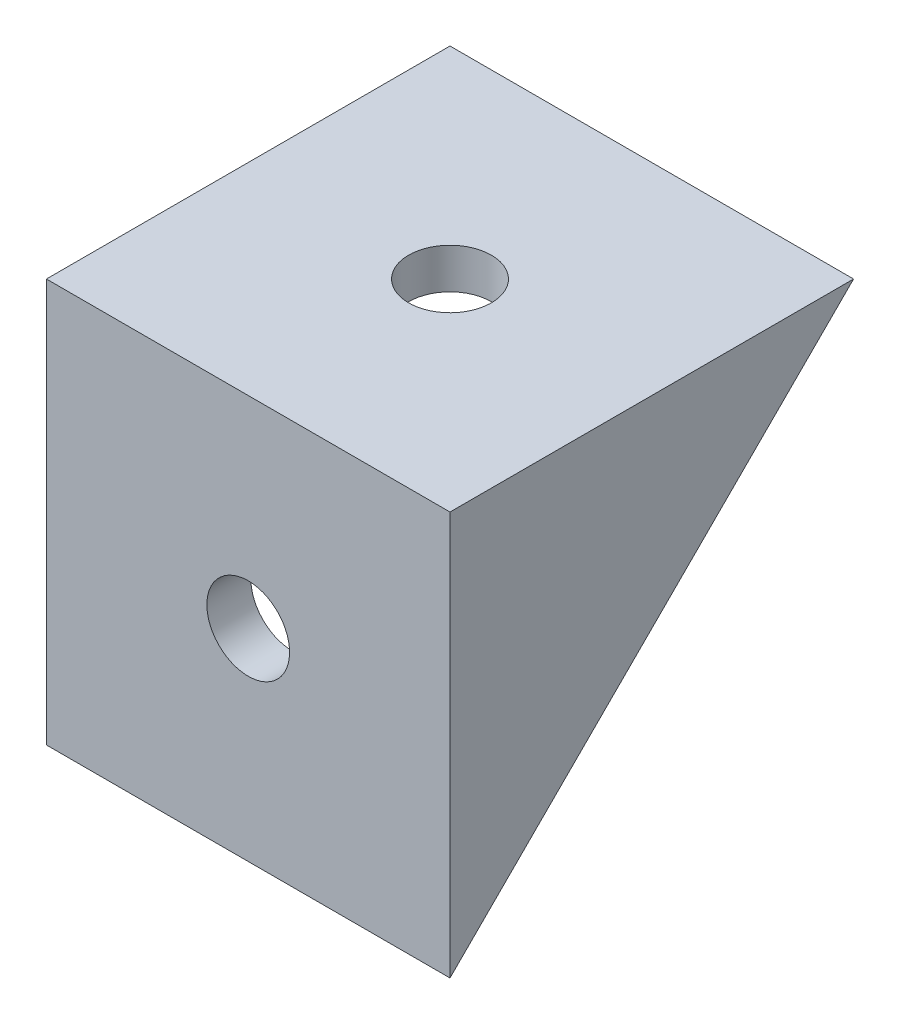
SolidWorks part; units mm, degrees
ref_plane "Ebene vorne" through (0, 0, 0) normal (0, 0, 1) x (1, 0, 0)
ref_plane "Ebene oben" through (0, 0, 0) normal (0, 1, 0) x (1, 0, 0)
ref_plane "Ebene rechts" through (0, 0, 0) normal (1, 0, 0) x (0, 0, -1)
sketch "Skizze1" plane through (0, 0, 0) normal (1, 0, 0) x (0, 0, -1)
  line L0 (40, 0) -> (0, -40)
  line L1 (0, 0) -> (40, 0)
  line L2 (0, 0) -> (0, -40)
  point P2 (0, 0)
  dimension "D1" = 40
  dimension "D2" = 40
extrude "Aufsatz-Linear austragen1" add sketch "Skizze1" along normal mid plane 40
sketch "Skizze2" plane through (0, 0, 0) normal (1, 0, 0) x (0, 0, -1)
  line L0 (40, 0) -> (0, 0) construction
  line L1 (4.3631, -4) -> (49.9166, -4)
  line L2 (4.3631, -4) -> (4.3631, -50.5753)
  line L3 (4.3631, -50.5753) -> (49.9166, -50.5753)
  line L4 (49.9166, -4) -> (49.9166, -50.5753)
  line L6 (0, 0) -> (0, -40) construction
  dimension "D1" = 4
  dimension "D2" = 4.3631
extrude "Schnitt-Linear austragen1" cut sketch "Skizze2" against normal mid plane 30
sketch "Skizze3" plane through (0, 0, -4.3631) normal (0, 0, -1) x (-1, 0, 0)
  line L0 (-20, -40) -> (20, -40) construction
  line L1 (0, 53.599) -> (0, -53.599) construction
  circle A0 centre (0, -20) radius 4.1
  dimension "D2" = 8.2
  dimension "D1" = 20
extrude "Schnitt-Linear austragen2" cut sketch "Skizze3" against normal blind 30
sketch "Skizze4" plane through (0, -4, 0) normal (0, -1, 0) x (1, 0, 0)
  line L0 (0, -53.599) -> (0, 53.599) construction
  line L1 (20, -40) -> (-20, -40) construction
  circle A0 centre (0, -20) radius 4.1
  dimension "D1" = 8.2
  dimension "D2" = 20
extrude "Schnitt-Linear austragen3" cut sketch "Skizze4" against normal blind 30
